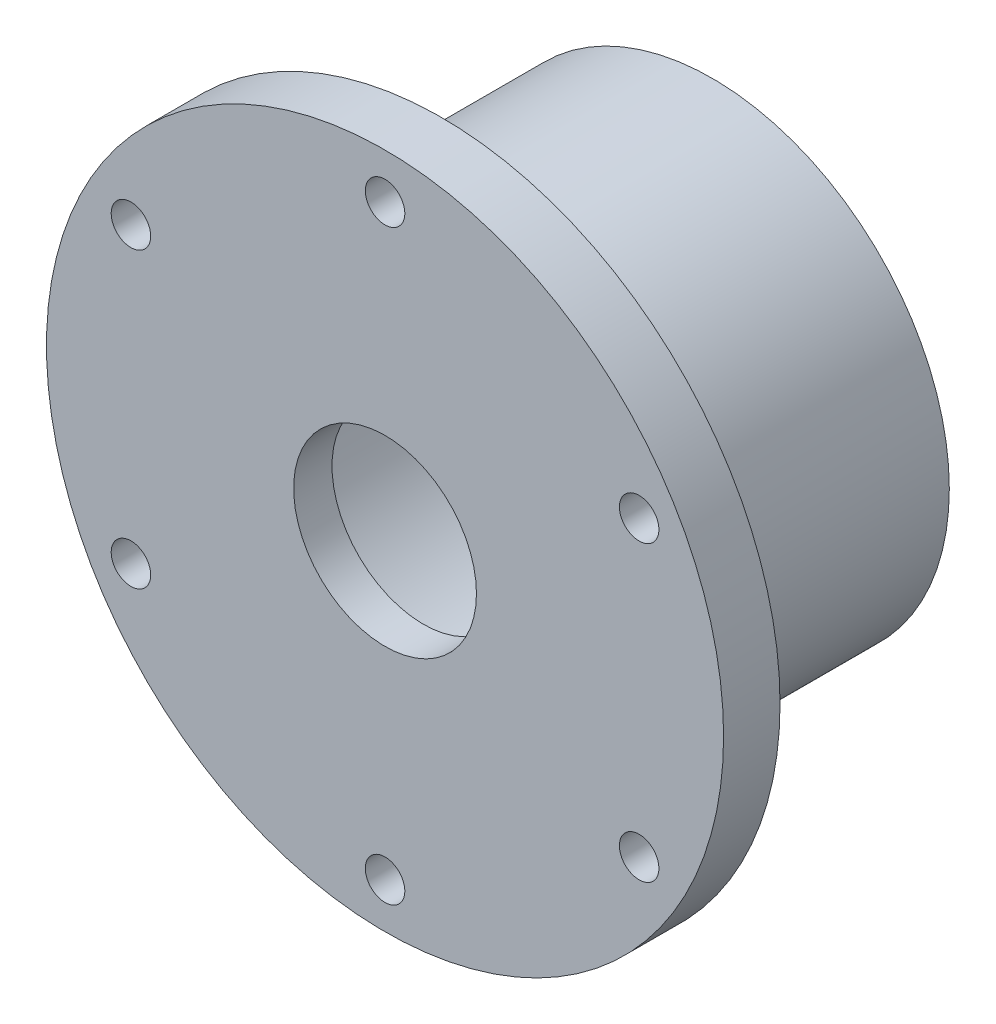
SolidWorks part; units mm, degrees
ref_plane "Front Plane" through (0, 0, 0) normal (0, 0, 1) x (1, 0, 0)
ref_plane "Top Plane" through (0, 0, 0) normal (0, 1, 0) x (1, 0, 0)
ref_plane "Right Plane" through (0, 0, 0) normal (1, 0, 0) x (0, 0, -1)
sketch "Sketch1" plane through (0, 0, 0) normal (1, 0, 0) x (0, 0, -1)
  line L0 (0, 150) -> (0, 40.5)
  line L1 (0, 40.5) -> (17, 40.5)
  line L2 (17, 40.5) -> (17, 69.5)
  line L3 (17, 69.5) -> (22, 69.5)
  line L4 (22, 69.5) -> (22, 79.5)
  line L7 (0, 150) -> (25, 150)
  line L8 (25, 150) -> (25, 105)
  line L9 (25, 105) -> (145, 105)
  line L10 (145, 105) -> (145, 79.5)
  line L11 (145, 79.5) -> (22, 79.5)
  line L13 (0, 0) -> (200.7353, 0) construction
  dimension "D2" = 17
  dimension "D3" = 5
  dimension "D4" = 10
  dimension "D5" = 29
  dimension "D6" = 25
  dimension "D7" = 40.5
  dimension "D8" = 150
  dimension "D9" = 105
  dimension "D10" = 120
revolve "Revolve1" add sketch "Sketch1" angle 360 about L13
hole_wizard "M8 Tapped Hole2" positions "Sketch2" profile "Sketch3" tap size "M8" standard "DIN"
sketch "Sketch2" plane through (0, 0, -145) normal (0, 0, -1) x (-1, 0, 0)
  line L0 (0, 0) -> (0, 90) construction
  point P0 (0, 90)
  dimension "D1" = 90
sketch "Sketch3" plane through (0, 90, -145) normal (1, 0, 0) x (0, 1, 0)
  line L0 (0, 0) -> (0, 28.0429)
  line L1 (0, 28.0429) -> (3.4, 26)
  line L2 (3.4, 26) -> (3.4, 0)
  line L5 (3.4, 0) -> (0, 0)
  line L10 (0, 28.0429) -> (-3.4, 26) construction
  line L11 (0, -6.35) -> (0, 107.95) construction
  dimension "Tap Drill Dia." = 6.8
  dimension "Tap Drill Depth" = 26
  dimension "Drill Angle" = 118
pattern_circular "CirPattern1" count 6 over 360 about axis through (0, 0, 0) along (0, 0, 1) of "M8 Tapped Hole2"
hole_wizard "Ø17.5 (17.5) Diameter Hole1" positions "Sketch5" profile "Sketch7" hole size "Ø17.5" standard "DIN"
sketch "Sketch5" plane through (0, 0, -25) normal (0, 0, -1) x (-1, 0, 0)
  line L0 (0, 0) -> (0, 130) construction
  point P0 (0, 130)
  dimension "D1" = 130
sketch "Sketch7" plane through (0, 130, -25) normal (1, 0, 0) x (0, 1, 0)
  line L0 (0, 0) -> (0, 31.2575)
  line L1 (0, 31.2575) -> (8.75, 26)
  line L2 (8.75, 26) -> (8.75, 0)
  line L5 (8.75, 0) -> (0, 0)
  line L10 (0, 31.2575) -> (-8.75, 26) construction
  line L11 (0, -6.35) -> (0, 107.95) construction
  dimension "Hole Dia." = 17.5
  dimension "Hole Depth" = 26
  dimension "Drill Angle" = 118
pattern_circular "CirPattern2" count 6 over 360 about axis through (0, 0, 0) along (0, 0, 1) of "Ø17.5 (17.5) Diameter Hole1"
